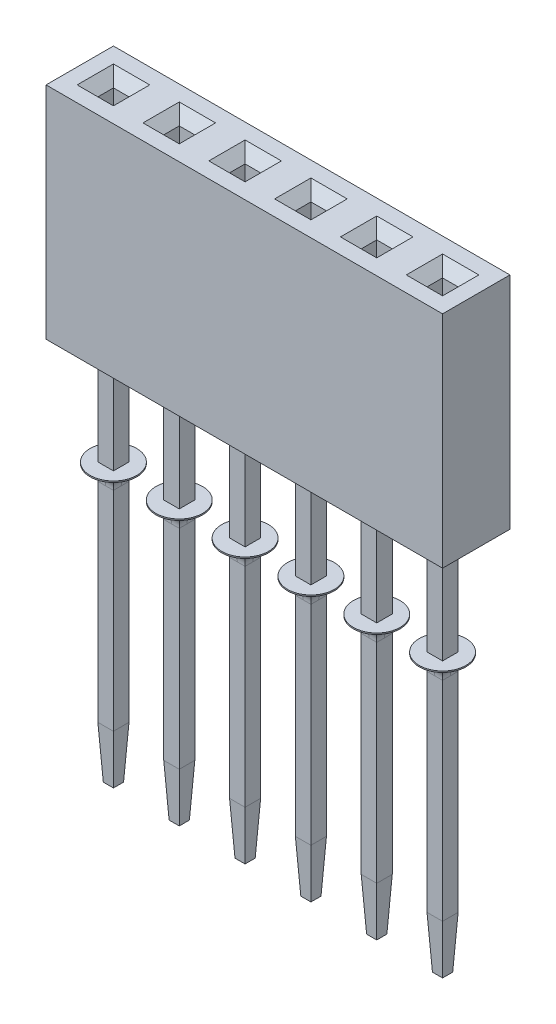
SolidWorks part; units mm, degrees
ref_plane "Plan de face" through (0, 0, 0) normal (0, 0, 1) x (1, 0, 0)
ref_plane "Plan de dessus" through (0, 0, 0) normal (0, 1, 0) x (1, 0, 0)
ref_plane "Plan de droite" through (0, 0, 0) normal (1, 0, 0) x (0, 0, -1)
sketch "Esquisse1" plane through (0, 0, 0) normal (0, 1, 0) x (1, 0, 0)
  line L1 (-1.3, -1.3) -> (1.3, -1.3)
  line L2 (-1.3, -1.3) -> (-1.3, 1.3)
  line L3 (-1.3, 1.3) -> (1.3, 1.3)
  line L4 (1.3, -1.3) -> (1.3, 1.3)
  line L5 (-1.3, -1.3) -> (1.3, 1.3) construction
  line L6 (-1.3, 1.3) -> (1.3, -1.3) construction
  line L7 (-0.3, -0.3) -> (0.3, -0.3)
  line L8 (-0.3, -0.3) -> (-0.3, 0.3)
  line L9 (-0.3, 0.3) -> (0.3, 0.3)
  line L10 (0.3, -0.3) -> (0.3, 0.3)
  line L11 (-0.3, -0.3) -> (0.3, 0.3) construction
  line L12 (-0.3, 0.3) -> (0.3, -0.3) construction
  point P0 (0, 0)
  point P5 (0, 0)
  dimension "D1" = 2.6
  dimension "D2" = 0.6
extrude "Boss.-Extru.1" add sketch "Esquisse1" along normal blind 8.5
chamfer "Chanfrein1" distance 0.4 angle 45 4 edges at (0.3, 8.5, 0) (0, 8.5, 0.3) (-0.3, 8.5, 0) (0, 8.5, -0.3)
sketch "Esquisse2" plane through (0, 0, 0) normal (0, -1, 0) x (1, 0, 0)
  line L1 (-0.3, -0.3) -> (0.3, -0.3)
  line L2 (-0.3, -0.3) -> (-0.3, 0.3)
  line L3 (-0.3, 0.3) -> (0.3, 0.3)
  line L4 (0.3, -0.3) -> (0.3, 0.3)
extrude "Boss.-Extru.2" add sketch "Esquisse2" along normal blind 14.8 separate body
chamfer "Chanfrein2" distance 2 angle 3 4 edges at (0, -14.8, 0.3) (0.3, -14.8, 0) (0, -14.8, -0.3) (-0.3, -14.8, 0)
ref_plane "Plan1" through (0, -4.1, 0) normal (0, -1, 0) x (-1, 0, 0)
sketch "Esquisse4" plane through (0, -4.1, 0) normal (0, -1, 0) x (-1, 0, 0)
  circle A0 centre (0, 0) radius 0.9
extrude "Boss.-Extru.3" add sketch "Esquisse4" along normal blind 0.05
fillet "Congé1" radius 0.6 4 edges at (0, -4.15, -0.3) (0.3, -4.15, 0) (0, -4.15, 0.3) (-0.3, -4.15, 0)
pattern_linear "Répétition linéaire4" count 6 spacing 2.54 along (1, 0, 0) of "Boss.-Extru.1", "Chanfrein1"
pattern_linear "Répétition linéaire6" count 6 spacing 2.54
